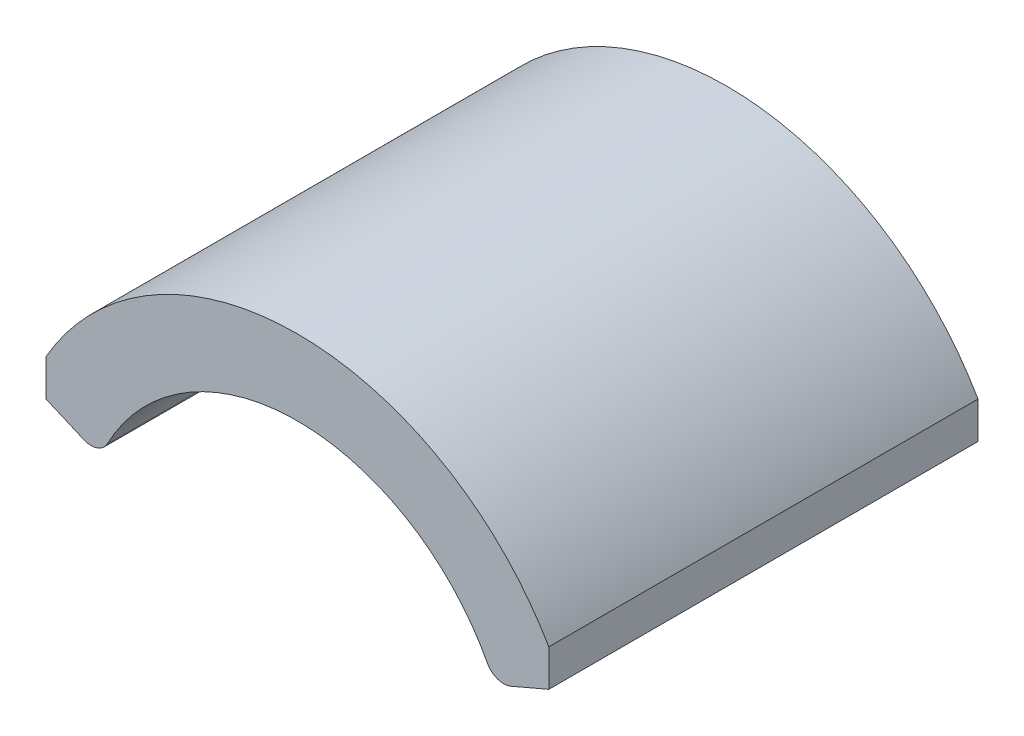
SolidWorks part; units mm, degrees
ref_plane "Plan1" through (0, 0, 0) normal (0, 0, 1) x (1, 0, 0)
ref_plane "Plan2" through (0, 0, 0) normal (0, 1, 0) x (1, 0, 0)
ref_plane "Plan3" through (0, 0, 0) normal (1, 0, 0) x (0, 0, -1)
ref_plane "Plan4" through (0, 0, -15) normal (0, 0, 1) x (1, 0, 0)
sketch "Esquisse2" plane through (0, 0, -15) normal (0, 0, 1) x (1, 0, 0)
  line L0 (0, 24.7771) -> (0, 54.9705) construction
  line L1 (20.5, 36.57) -> (20.5, 33.5698)
  line L2 (-20.5, 36.57) -> (-20.5, 33.5698)
  line L3 (0, 24.7771) -> (-27.7788, 24.7771) construction
  line L4 (-7.9956, 32.2771) -> (-27.7788, 32.2771) construction
  line L5 (-17.4071, 32.2432) -> (-20.5, 33.5698)
  line L6 (17.4071, 32.2432) -> (20.5, 33.5698)
  arc A0 (-15.4883, 32.9235) -> (-17.4071, 32.2432) centre (-16.8158, 33.6218) cw
  arc A1 (15.4883, 32.9235) -> (17.4071, 32.2432) centre (16.8158, 33.6218) ccw
  arc A3 (-22.7814, 31.1278) -> (-22.1634, 33.0299) centre (0, 24.7771) ccw construction
  arc A4 (20.5, 36.57) -> (-20.5, 36.57) centre (0, 24.7771) ccw
  arc A5 (15.4883, 32.9235) -> (-15.4883, 32.9235) centre (0, 24.7771) ccw
  dimension "D1" = 41
  dimension "D2" = 7.5
  dimension "D3" = 35
  dimension "D4" = 1.5
extrude "Base-Extrusion" add sketch "Esquisse2" against normal blind 35
